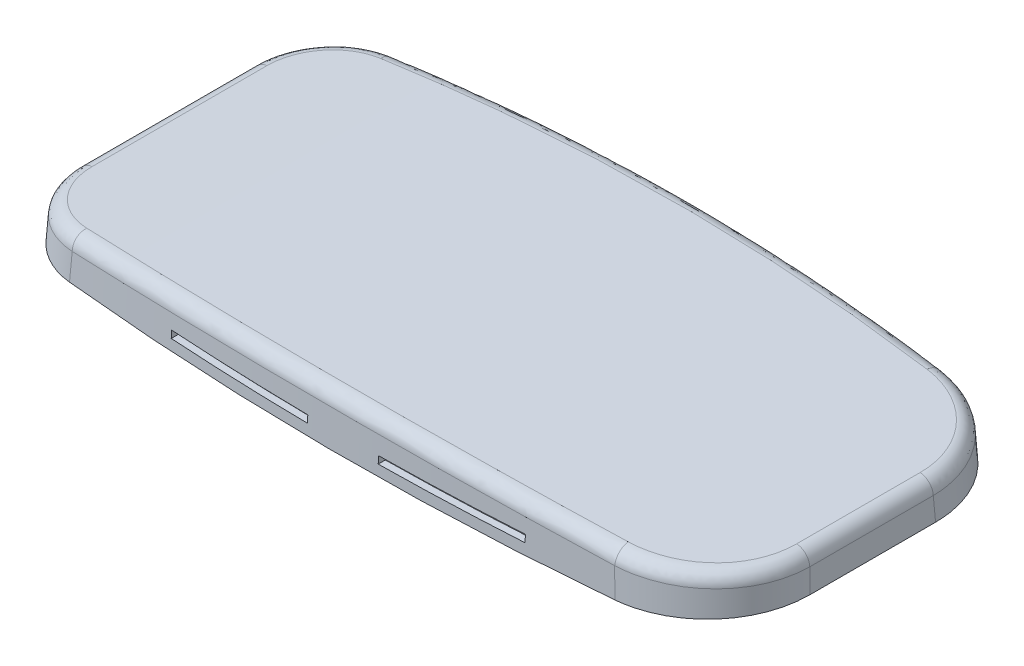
SolidWorks part; units mm, degrees
ref_plane "Front Plane" through (0, 0, 0) normal (0, 0, 1) x (1, 0, 0)
ref_plane "Top Plane" through (0, 0, 0) normal (0, 1, 0) x (1, 0, 0)
ref_plane "Right Plane" through (0, 0, 0) normal (1, 0, 0) x (0, 0, -1)
sketch "Sketch1" plane through (0, 0, 0) normal (0, 0, 1) x (1, 0, 0)
  line L0 (-50, 0) -> (50, 0)
  line L1 (50, 0) -> (50, 5)
  line L2 (-50, 0) -> (-50, 5)
  arc A0 (-50, 5) -> (50, 5) centre (0, -653.1033) cw
  point P6 (0, 0)
  point P10 (50, 5)
  point P13 (-50, 5)
  dimension "D2" = 660
  dimension "D1" = 100
  dimension "D3" = 5
extrude "Boss-Extrude1" add sketch "Sketch1" along normal mid plane 50
sketch "Sketch2" plane through (0, 0, 0) normal (0, 1, 0) x (1, 0, 0)
  line L4 (-50, 0) -> (50, 0) construction
  line L5 (0, 0) -> (0, 25) construction
  line L7 (-50, -25) -> (-50, 25) construction
  line L8 (50, 25) -> (-50, 25) construction
  line L10 (50, -21.8627) -> (50, 21.8627)
  line L11 (-50, -21.8627) -> (-50, 21.8627)
  line L12 (50, -25) -> (50, 25) construction
  line L13 (-50, -25) -> (50, -25) construction
  arc A4 (-50, 21.8627) -> (50, 21.8627) centre (0, -375) cw
  arc A5 (-50, -21.8627) -> (50, -21.8627) centre (0, 375) ccw
  dimension "D1" = 400
extrude "Cut-Extrude1" cut sketch "Sketch2" along normal up to next flip side to cut
draft "Draft1" type of draft neutral plane draft angle 3 faces to draft 1 parameters "D1"=3
fillet "Fillet1" radius 10.5 2 edges
fillet "Fillet2" radius 14.5 2 edges
fillet "Fillet3" radius 2 8 edges at (-49.7369, 5.0199, 0) (-46.6029, 5.2493, -19.7237) (46.5942, 5.2499, -17.6255) (49.7369, 5.0199, 0) (45.3123, 5.3394, 19.0313) (-47.4615, 5.1879, 18.7733)
shell "Shell1" thickness 1
sketch "Sketch4" plane through (0, 0, 0) normal (0, 0, 1) x (1, 0, 0)
  line L12 (-25, 2.5) -> (-5, 2.5)
  line L13 (-25, 2.5) -> (-25, 1.5)
  line L14 (-25, 1.5) -> (-5, 1.5)
  line L15 (-5, 2.5) -> (-5, 1.5)
  line L16 (5, 2.5) -> (25, 2.5)
  line L17 (5, 2.5) -> (5, 1.5)
  line L18 (5, 1.5) -> (25, 1.5)
  line L19 (25, 2.5) -> (25, 1.5)
  line L20 (-40.5781, 0) -> (36.854, 0) construction
  dimension "D1" = 25
  dimension "D2" = 20
  dimension "D3" = 20
  dimension "D4" = 25
  dimension "D5" = 1.5
  dimension "D6" = 1
extrude "Cut-Extrude2" cut sketch "Sketch4" against normal through all both and the other way through all
sketch "Sketch3" plane through (0, 0, 0) normal (0, -1, 0) x (1, 0, 0)
  line L0 (-49, 12.5) -> (48.5006, 12.5)
  line L1 (-49, -12.5) -> (48.5006, -12.5)
  line L2 (-32, 22.7133) -> (-32, -22.7133)
  line L3 (32, 22.7133) -> (32, -22.7133)
  line L4 (0, 23.9986) -> (0, -23.9986)
  line L5 (-48.9986, 0) -> (48.9986, 0) construction
  line L8 (48.9986, 8.8776) -> (48.9986, -8.8776) construction
  line L9 (-48.9986, 12.5025) -> (-48.9986, -12.5025) construction
  line L10 (-50, 12.5049) -> (-50, -12.5049) construction
  line L11 (50, 8.8801) -> (50, -8.8801) construction
  line L14 (-48.9986, 12.5025) -> (-48.9986, -12.5025)
  line L15 (48.9986, -8.8776) -> (48.9986, 8.8776)
  line L16 (-48.9986, 12.5025) -> (-48.9986, -12.5025) construction
  line L17 (48.9986, -8.8776) -> (48.9986, 8.8776) construction
  arc A7 (-40.474, -21.9405) -> (36.7592, -22.3017) centre (0, 375) ccw
  arc A10 (36.7592, 22.3017) -> (-40.474, 21.9405) centre (0, -375) ccw
  arc A13 (-40.474, -21.9405) -> (36.7592, -22.3017) centre (0, 375) ccw construction
  arc A16 (36.7592, 22.3017) -> (-40.474, 21.9405) centre (0, -375) ccw construction
  spline S4 degree 3 poles (-921.9558, 2817.5178) (-208.8629, 399.5199) (-23.8307, -39.7391) (39.5999, -21.7332) (39.9925, -21.6021) (40.7676, -21.3026) (41.1521, -21.1333) (42.272, -20.5763) (42.975, -20.141) (43.9656, -19.3943) (44.2851, -19.1297) (44.9021, -18.5682) (45.1992, -18.2713) (46.0389, -17.3508) (46.5369, -16.6917) (47.4106, -15.2832) (47.7873, -14.5275) (48.386, -12.9829) (48.6129, -12.1884) (48.8432, -10.9629) (48.9016, -10.5472) (56.686, 72.9948) (-706.8595, 205.9806) (-2914.8498, 432.3428) knots -9.788438 -9.788438 -9.788438 -9.788438 0.125 0.125 0.1875 0.1875 0.25 0.25 0.375 0.375 0.4375 0.4375 0.5 0.5 0.625 0.625 0.75 0.75 0.875 0.875 0.9375 0.9375 13.411988 13.411988 13.411988 13.411988 only from (36.7592, -22.3017) to (48.9986, -8.8776)
  spline S5 degree 3 poles (36.7592, -22.3017) (37.5936, -22.2245) (38.4078, -22.0716) (39.5999, -21.7332) (39.9925, -21.6021) (40.7676, -21.3026) (41.1521, -21.1333) (42.272, -20.5763) (42.975, -20.141) (43.9656, -19.3943) (44.2851, -19.1297) (44.9021, -18.5682) (45.1992, -18.2713) (46.0389, -17.3508) (46.5369, -16.6917) (47.4106, -15.2832) (47.7873, -14.5275) (48.386, -12.9829) (48.6129, -12.1884) (48.8432, -10.9629) (48.9016, -10.5472) (48.9792, -9.7143) (48.9986, -9.2966) (48.9986, -8.8776) knots 0 0 0 0 0.125 0.125 0.1875 0.1875 0.25 0.25 0.375 0.375 0.4375 0.4375 0.5 0.5 0.625 0.625 0.75 0.75 0.875 0.875 0.9375 0.9375 1 1 1 1 construction
  spline S6 degree 3 poles (2876.2776, 644.3041) (363.3242, 163.1209) (-58.4684, 37.7414) (-48.7871, -14.5173) (-48.7215, -14.7992) (-48.5639, -15.3583) (-48.4714, -15.6371) (-48.1575, -16.4538) (-47.9011, -16.9721) (-47.4477, -17.7114) (-47.2849, -17.9515) (-46.9358, -18.4184) (-46.7492, -18.6454) (-46.165, -19.2924) (-45.7401, -19.6839) (-44.8202, -20.388) (-44.3203, -20.7022) (-43.2865, -21.2261) (-42.7495, -21.4392) (-10.468, -30.9378) (89.3222, 121.7167) (-2737.2598, 1279.9597) knots -11.311871 -11.311871 -11.311871 -11.311871 0.125 0.125 0.1875 0.1875 0.25 0.25 0.375 0.375 0.4375 0.4375 0.5 0.5 0.625 0.625 0.75 0.75 0.875 0.875 7.992174 7.992174 7.992174 7.992174 only from (-48.9986, -12.5025) to (-40.474, -21.9405)
  spline S7 degree 3 poles (-48.9986, -12.5025) (-48.9986, -13.0884) (-48.9449, -13.6653) (-48.7871, -14.5173) (-48.7215, -14.7992) (-48.5639, -15.3583) (-48.4714, -15.6371) (-48.1575, -16.4538) (-47.9011, -16.9721) (-47.4477, -17.7114) (-47.2849, -17.9515) (-46.9358, -18.4184) (-46.7492, -18.6454) (-46.165, -19.2924) (-45.7401, -19.6839) (-44.8202, -20.388) (-44.3203, -20.7022) (-43.2865, -21.2261) (-42.7495, -21.4392) (-41.6351, -21.7671) (-41.0569, -21.8811) (-40.474, -21.9405) knots 0 0 0 0 0.125 0.125 0.1875 0.1875 0.25 0.25 0.375 0.375 0.4375 0.4375 0.5 0.5 0.625 0.625 0.75 0.75 0.875 0.875 1 1 1 1 construction
  spline S8 degree 3 poles (909.6807, -2821.6184) (176.0687, -370.4396) (8.55, 36.4581) (-42.457, 21.5256) (-42.7307, 21.4318) (-43.271, 21.2183) (-43.539, 21.098) (-44.3196, 20.7029) (-44.8093, 20.3952) (-45.4988, 19.8691) (-45.7211, 19.6829) (-46.1502, 19.2882) (-46.357, 19.0795) (-46.9415, 18.4327) (-47.2878, 17.9703) (-47.895, 16.9837) (-48.1569, 16.4545) (-48.5732, 15.3729) (-48.7307, 14.8171) (-54.9057, -18.2614) (107.0836, -102.0517) (972.6233, 2827.4331) knots -11.31186 -11.31186 -11.31186 -11.31186 0.125 0.125 0.1875 0.1875 0.25 0.25 0.375 0.375 0.4375 0.4375 0.5 0.5 0.625 0.625 0.75 0.75 0.875 0.875 7.992167 7.992167 7.992167 7.992167 only from (-40.474, 21.9405) to (-48.9986, 12.5025)
  spline S9 degree 3 poles (-40.474, 21.9405) (-41.0569, 21.8811) (-41.6253, 21.7691) (-42.457, 21.5256) (-42.7307, 21.4318) (-43.271, 21.2183) (-43.539, 21.098) (-44.3196, 20.7029) (-44.8093, 20.3952) (-45.4988, 19.8691) (-45.7211, 19.6829) (-46.1502, 19.2882) (-46.357, 19.0795) (-46.9415, 18.4327) (-47.2878, 17.9703) (-47.895, 16.9837) (-48.1569, 16.4545) (-48.5732, 15.3729) (-48.7307, 14.8171) (-48.9439, 13.6752) (-48.9986, 13.0884) (-48.9986, 12.5025) knots 0 0 0 0 0.125 0.125 0.1875 0.1875 0.25 0.25 0.375 0.375 0.4375 0.4375 0.5 0.5 0.625 0.625 0.75 0.75 0.875 0.875 1 1 1 1 construction
  spline S10 degree 3 poles (-2867.0612, -684.1304) (-393.6579, -196.838) (60.7798, -53.0611) (48.6942, 11.7587) (48.5998, 12.1616) (48.3731, 12.961) (48.2398, 13.3595) (47.7884, 14.5259) (47.4197, 15.2661) (46.7675, 16.3213) (46.5334, 16.6638) (46.0312, 17.3299) (45.7629, 17.653) (44.9237, 18.5739) (44.3133, 19.1306) (42.9913, 20.1303) (42.2735, 20.575) (40.7906, 21.3135) (40.0204, 21.6126) (38.8213, 21.9548) (38.4128, 22.0513) (-44.0568, 37.4992) (-246.8214, -710.5473) (-675.6425, -2888.3094) knots -9.788438 -9.788438 -9.788438 -9.788438 0.125 0.125 0.1875 0.1875 0.25 0.25 0.375 0.375 0.4375 0.4375 0.5 0.5 0.625 0.625 0.75 0.75 0.875 0.875 0.9375 0.9375 13.411988 13.411988 13.411988 13.411988 only from (48.9986, 8.8776) to (36.7592, 22.3017)
  spline S11 degree 3 poles (48.9986, 8.8776) (48.9986, 9.7155) (48.9214, 10.5404) (48.6942, 11.7587) (48.5998, 12.1616) (48.3731, 12.961) (48.2398, 13.3595) (47.7884, 14.5259) (47.4197, 15.2661) (46.7675, 16.3213) (46.5334, 16.6638) (46.0312, 17.3299) (45.7629, 17.653) (44.9237, 18.5739) (44.3133, 19.1306) (42.9913, 20.1303) (42.2735, 20.575) (40.7906, 21.3135) (40.0204, 21.6126) (38.8213, 21.9548) (38.4128, 22.0513) (37.5905, 22.2053) (37.1764, 22.2631) (36.7592, 22.3017) knots 0 0 0 0 0.125 0.125 0.1875 0.1875 0.25 0.25 0.375 0.375 0.4375 0.4375 0.5 0.5 0.625 0.625 0.75 0.75 0.875 0.875 0.9375 0.9375 1 1 1 1 construction
  dimension "D1" = 25
  dimension "D2" = 18
  dimension "D3" = 18
  dimension "D4" = 0
rib "Rib1" sketch "Sketch3" sketch "Sketch3" thickness 1 extrusion direction normal to sketch draft on no parameters "D1"=1
scale "Scale1" scale about centroid uniform scaling yes scale factor 1.1
surface "Surface-Fill1"
surface "Surface-Fill2"
surface "Surface-Fill3"
surface "Surface-Fill4"
surface "Surface-Fill5"
surface "Surface-Fill6"
surface "Surface-Fill7"
surface "Surface-Fill8"
